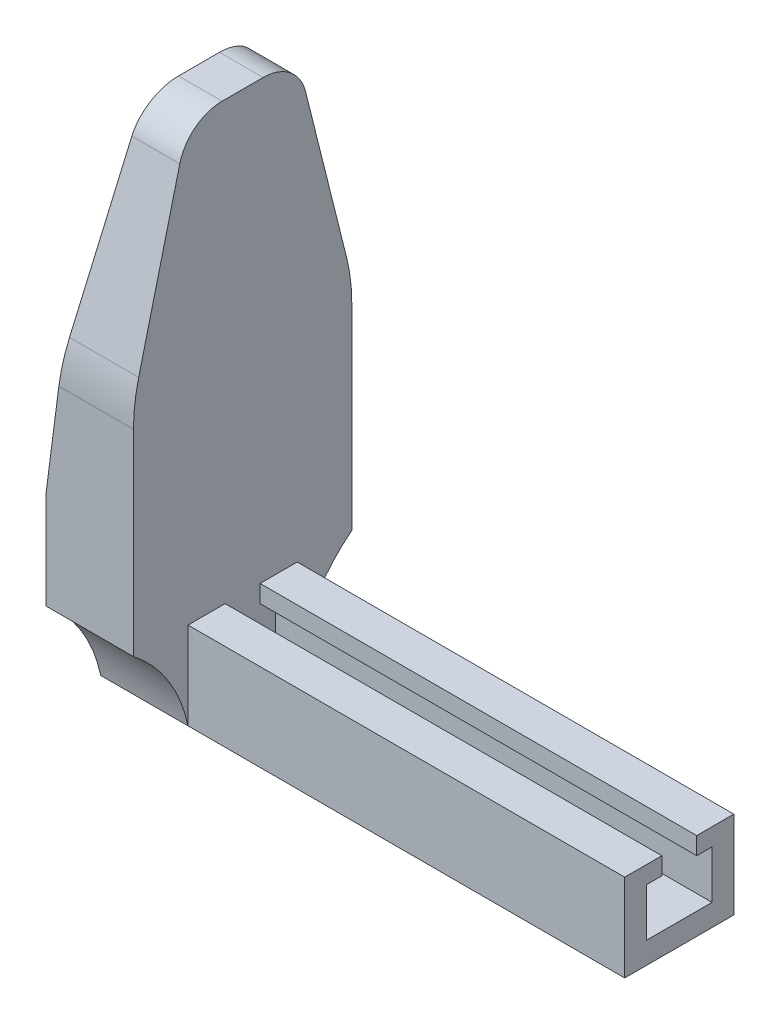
SolidWorks part; units mm, degrees
ref_plane "Front Plane" through (0, 0, 0) normal (0, 0, 1) x (1, 0, 0)
ref_plane "Top Plane" through (0, 0, 0) normal (0, 1, 0) x (1, 0, 0)
ref_plane "Right Plane" through (0, 0, 0) normal (1, 0, 0) x (0, 0, -1)
sketch "Sketch1" plane through (0, 0, 0) normal (1, 0, 0) x (0, 0, -1)
  line L0 (4, 10) -> (12.5, 10)
  line L1 (-12.5, -10) -> (12.5, -10)
  line L2 (-12.5, -10) -> (-12.5, 10)
  line L3 (-12.5, 10) -> (-4, 10)
  line L4 (12.5, -10) -> (12.5, 10)
  line L5 (-12.5, -10) -> (12.5, 10) construction
  line L6 (-12.5, 10) -> (12.5, -10) construction
  line L7 (-7.5, 6) -> (-4, 6)
  line L8 (-7.5, 6) -> (-7.5, -5)
  line L9 (-7.5, -5) -> (7.5, -5)
  line L10 (7.5, 6) -> (7.5, -5)
  line L12 (-4, 10) -> (-4, 6)
  line L14 (4, 10) -> (4, 6)
  line L15 (4, 6) -> (7.5, 6)
  point P0 (0, 0)
  dimension "D1" = 25
  dimension "D2" = 20
  dimension "D3" = 5
  dimension "D4" = 5
  dimension "D5" = 8.5
  dimension "D6" = 8.5
  dimension "D7" = 5
extrude "Boss-Extrude1" add sketch "Sketch1" along normal blind 100
sketch "Sketch2" plane through (0, 0, 0) normal (1, 0, 0) x (0, 0, -1)
  line L3 (-12.5, -10) -> (12.5, -10)
  line L6 (-25, 10) -> (-25, 55.0758)
  line L7 (-4.6922, 110) -> (4.6922, 110)
  line L8 (25, 10) -> (25, 55.0758)
  line L9 (0, 0) -> (0, 6.5229)
  line L10 (23.8057, 64.7772) -> (14.3937, 102.4254)
  line L11 (-23.8057, 64.7772) -> (-14.3937, 102.4254)
  arc A0 (25, 10) -> (12.5, -10) centre (46.0273, -17.0483) ccw
  arc A1 (-25, 10) -> (-12.5, -10) centre (-46.0273, -17.0483) cw
  arc A2 (-23.8057, 64.7772) -> (-25, 55.0758) centre (15, 55.0758) ccw
  arc A3 (23.8057, 64.7772) -> (25, 55.0758) centre (-15, 55.0758) cw
  arc A4 (-14.3937, 102.4254) -> (-4.6922, 110) centre (-4.6922, 100) cw
  arc A5 (14.3937, 102.4254) -> (4.6922, 110) centre (4.6922, 100) ccw
  dimension "D1" = 40
  dimension "D2" = 10
extrude "Boss-Extrude2" add sketch "Sketch2" against normal blind 20 contours L8 A3 L10 A5 L7 A4 L11 A2 L6 A1 L3 A0
sketch "Sketch3" plane through (0, 0, 0) normal (0, 0, 1) x (1, 0, 0)
  line L0 (-10, 110) -> (-20, 32.5379)
  line L1 (-20, 110) -> (0, 110) construction
  line L2 (-20, 10) -> (-20, 55.0758) construction
  line L3 (-20, 32.5379) -> (-20, 110)
  line L4 (-20, 110) -> (-10, 110)
extrude "Cut-Extrude1" cut sketch "Sketch3" against normal through all both and the other way through all
